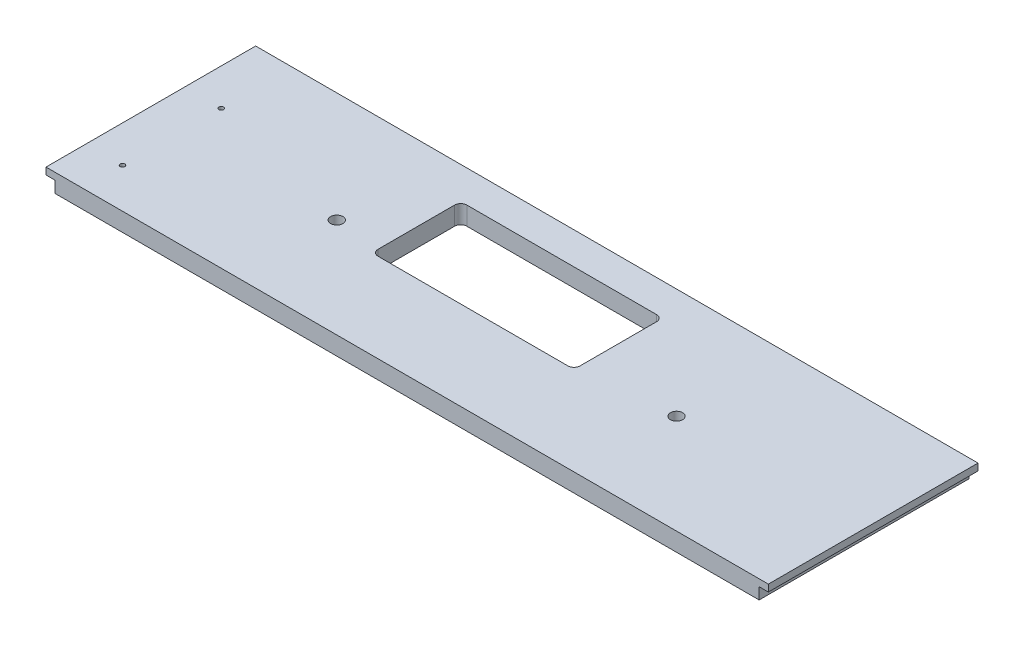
SolidWorks part; units mm, degrees
ref_plane "Front Plane" through (0, 0, 0) normal (0, 0, 1) x (1, 0, 0)
ref_plane "Top Plane" through (0, 0, 0) normal (0, 1, 0) x (1, 0, 0)
ref_plane "Right Plane" through (0, 0, 0) normal (1, 0, 0) x (0, 0, -1)
sketch "Sketch1" plane through (0, 0, 0) normal (0, 1, 0) x (1, 0, 0)
  line L1 (-374.65, 108.7437) -> (374.65, 108.7437)
  line L2 (-374.65, 108.7437) -> (-374.65, -108.7438)
  line L3 (-374.65, -108.7438) -> (374.65, -108.7438)
  line L4 (374.65, 108.7437) -> (374.65, -108.7438)
  line L5 (-374.65, 108.7437) -> (374.65, -108.7438) construction
  line L6 (-374.65, -108.7438) -> (374.65, 108.7437) construction
  point P0 (0, 0)
  dimension "D1" = 217.4875
  dimension "D2" = 749.3
extrude "Boss-Extrude1" add sketch "Sketch1" along normal blind 19.05
sketch "Sketch2" plane through (0, 19.05, 0) normal (0, 1, 0) x (1, 0, 0)
  line L0 (374.65, 108.7437) -> (-374.65, 108.7437) construction
  line L1 (-374.65, 108.7437) -> (-374.65, -108.7438) construction
  line L2 (-122.2375, 75.4062) -> (74.6125, 75.4062)
  line L3 (-128.5875, 69.0562) -> (-128.5875, -10.3187)
  line L4 (-122.2375, -16.6688) -> (74.6125, -16.6688)
  line L5 (80.9625, 69.0562) -> (80.9625, -10.3187)
  line L6 (-128.5875, 75.4062) -> (80.9625, -16.6688) construction
  line L7 (-128.5875, -16.6688) -> (80.9625, 75.4062) construction
  arc A0 (74.6125, -16.6688) -> (80.9625, -10.3187) centre (74.6125, -10.3188) ccw
  arc A1 (74.6125, 75.4062) -> (80.9625, 69.0562) centre (74.6125, 69.0562) cw
  arc A2 (-122.2375, 75.4062) -> (-128.5875, 69.0562) centre (-122.2375, 69.0562) ccw
  arc A3 (-128.5875, -10.3187) -> (-122.2375, -16.6688) centre (-122.2375, -10.3188) ccw
  dimension "D5" = 6.35
  dimension "D1" = 209.55
  dimension "D2" = 33.3375
  dimension "D3" = 92.075
  dimension "D4" = 246.0625
extrude "Cut-Extrude1" cut sketch "Sketch2" against normal through all
sketch "Sketch3" plane through (0, 0, 108.7438) normal (0, 0, 1) x (1, 0, 0)
  line L1 (374.65, 0) -> (365.125, 0)
  line L2 (374.65, 0) -> (374.65, 11.9062)
  line L3 (374.65, 11.9062) -> (365.125, 11.9062)
  line L4 (365.125, 0) -> (365.125, 11.9062)
  line L5 (-374.65, 0) -> (-365.125, 0)
  line L6 (-374.65, 0) -> (-374.65, 11.9062)
  line L7 (-374.65, 11.9062) -> (-365.125, 11.9062)
  line L8 (-365.125, 0) -> (-365.125, 11.9062)
  dimension "D1" = 9.525
  dimension "D2" = 11.9062
extrude "Cut-Extrude2" cut sketch "Sketch3" against normal through all
sketch "Sketch5" plane through (0, 19.05, 0) normal (0, 1, 0) x (1, 0, 0)
  line L0 (0, 0) -> (0, 310.8805) construction
  line L1 (-176.2125, -5.5563) -> (176.2125, -5.5563) construction
  line L2 (374.65, 108.7437) -> (-374.65, 108.7437) construction
  circle A0 centre (-176.2125, -5.5563) radius 6.35
  circle A1 centre (176.2125, -5.5563) radius 6.35
  point P5 (0, -5.5563)
  dimension "D2" = 12.7
  dimension "D1" = 352.425
  dimension "D3" = 114.3
extrude "Cut-Extrude3" cut sketch "Sketch5" against normal through all
sketch "Sketch6" plane through (0, 0, 0) normal (0, -1, 0) x (1, 0, 0)
  line L0 (-336.55, -34.925) -> (-336.55, 67.4688) construction
  line L1 (-365.125, -108.7437) -> (-365.125, 108.7438) construction
  line L2 (-365.125, 108.7438) -> (365.125, 108.7438) construction
  circle A0 centre (-336.55, -34.925) radius 2.413
  circle A1 centre (-336.55, 67.4688) radius 2.413
  dimension "D1" = 4.826
  dimension "D4" = 41.275
  dimension "D2" = 102.3937
  dimension "D3" = 28.575
extrude "Cut-Extrude4" cut sketch "Sketch6" against normal through all
sketch "Sketch7" plane through (0, 0, 0) normal (0, -1, 0) x (1, 0, 0)
  line L0 (-365.125, -108.7437) -> (-365.125, 108.7438) construction
  line L1 (-352.425, 92.8688) -> (352.425, 92.8688) construction
  line L2 (-352.425, 92.8688) -> (-352.425, -96.0437) construction
  line L3 (-352.425, -96.0437) -> (352.425, -96.0437) construction
  line L4 (352.425, 92.8688) -> (352.425, -96.0437) construction
  line L5 (365.125, -108.7437) -> (365.125, 108.7438) construction
  line L6 (-365.125, 108.7438) -> (365.125, 108.7438) construction
  line L7 (365.125, -108.7437) -> (-365.125, -108.7437) construction
  circle A0 centre (-352.425, -96.0437) radius 0.3969
  circle A1 centre (-352.425, 92.8688) radius 0.3969
  circle A2 centre (352.425, 92.8688) radius 0.3969
  circle A3 centre (352.425, -96.0437) radius 0.3969
  dimension "D1" = 0.7937
  dimension "D4" = 15.875
  dimension "D5" = 12.7
extrude "Cut-Extrude5" cut sketch "Sketch7" against normal blind 6.35
